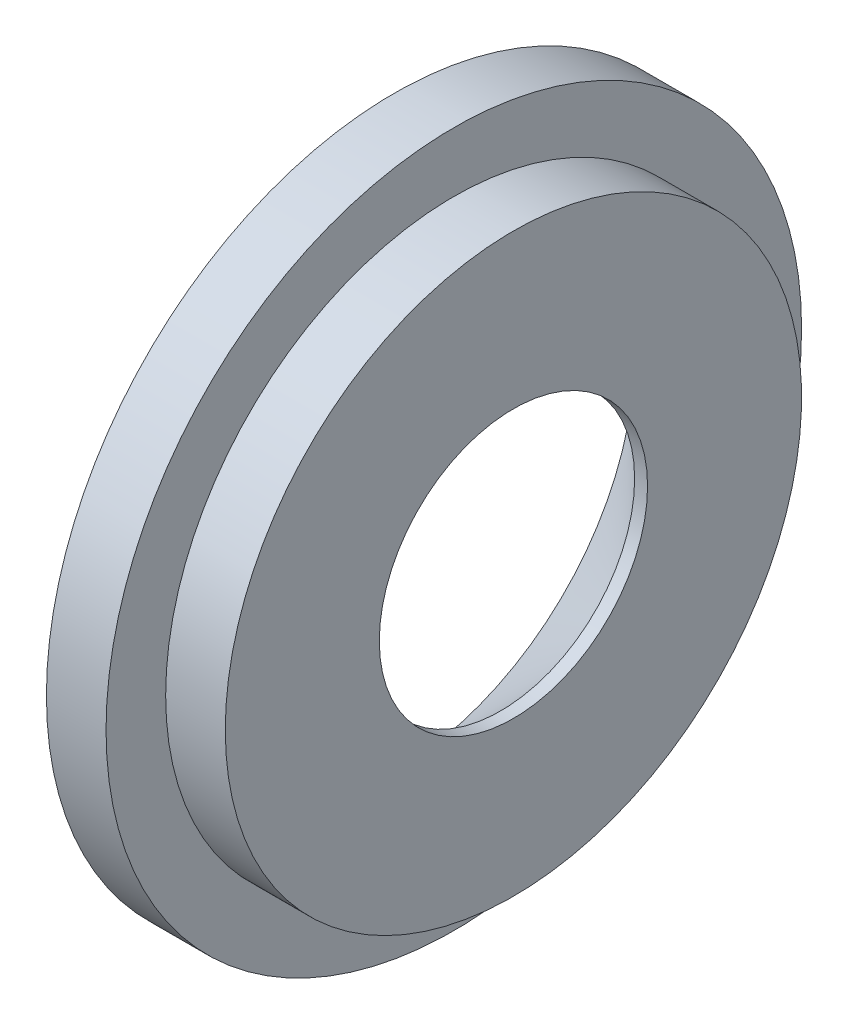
SolidWorks part; units mm, degrees
ref_plane "Face" through (0, 0, 0) normal (0, 0, 1) x (1, 0, 0)
ref_plane "Dessus" through (0, 0, 0) normal (0, 1, 0) x (1, 0, 0)
ref_plane "Droite" through (0, 0, 0) normal (1, 0, 0) x (0, 0, -1)
sketch "Esquisse1" plane through (0, 0, 0) normal (0, 0, 1) x (1, 0, 0)
  line L0 (0, 0) -> (15.1214, 0) construction
  line L1 (0, 17.5) -> (0, 12.1)
  line L2 (0, 12.1) -> (5.35, 6.75)
  line L3 (5.35, 6.75) -> (6, 6.75)
  line L4 (6, 6.75) -> (6, 14.5)
  line L5 (6, 14.5) -> (3, 14.5)
  line L6 (3, 14.5) -> (3, 17.5)
  line L7 (3, 17.5) -> (0, 17.5)
  dimension "D1" = 6
  dimension "D2" = 3
  dimension "D3" = 35
  dimension "D4" = 45
  dimension "D5" = 29
  dimension "D6" = 13.5
  dimension "D7" = 0.65
revolve "Base-Révolution" add sketch "Esquisse1" angle 360 about L0
